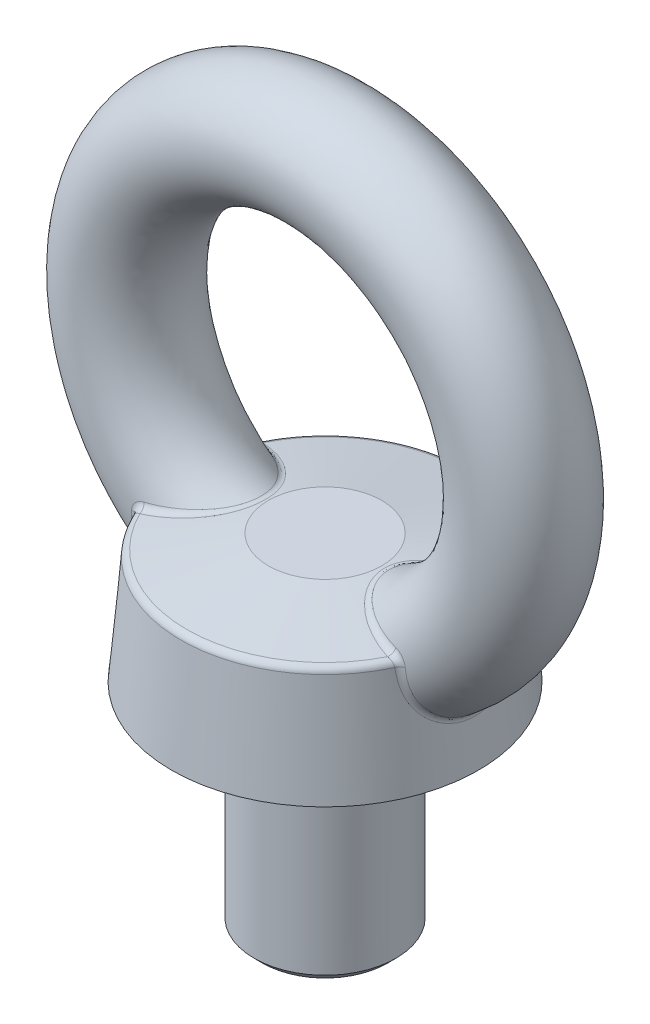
SolidWorks part; units mm, degrees
ref_plane "Front Plane" through (0, 0, 0) normal (0, 0, 1) x (1, 0, 0)
ref_plane "Top Plane" through (0, 0, 0) normal (0, 1, 0) x (1, 0, 0)
ref_plane "Right Plane" through (0, 0, 0) normal (1, 0, 0) x (0, 0, -1)
sketch "Sketch1" plane through (0, 0, 0) normal (0, 0, 1) x (1, 0, 0)
  ellipse E0 centre (0, 54.5) end of major axis (0, 0) minor radius 54
  dimension "D1" = 108
  dimension "D2" = 109
sketch "Sketch2" plane through (0, 0, 0) normal (1, 0, 0) x (0, 0, -1)
  line L3 (0, 109) -> (0, 0) construction
  circle A0 centre (0, 12) radius 12
  point P5 (0, 0)
sweep "Sweep1" add profiles "Sketch2" path "Sketch1"
sketch "Sketch3" plane through (0, 0, 0) normal (1, 0, 0) x (0, 0, -1)
  line L0 (0, 0) -> (-32.5, 0)
  line L1 (-32.5, 0) -> (-30.4003, 24)
  line L2 (-30.4003, 24) -> (-12, 27.2445)
  line L3 (-12, 27.2445) -> (0, 27.2445)
  line L4 (0, 27.2445) -> (0, 0)
revolve "Revolve1" add sketch "Sketch3" angle 360 about L4
fillet "Fillet1" radius 1.5 6 edges at (13.2045, 27.0185, -1.426) (31.5984, 10.3045, 0.0443) (-13.2045, 27.0185, 1.426) (-31.5984, 10.3045, -0.0443) (0, 24, -30.4003) (0, 24, 30.4003)
sketch "Sketch4" plane through (0, 0, 0) normal (0, -1, 0) x (1, 0, 0)
  circle A0 centre (0, 0) radius 15
  dimension "D1" = 30
extrude "Extrude1" add sketch "Sketch4" along normal blind 45
chamfer "Chamfer1" distance 1.75 angle 45 1 edges at (0, -45, -15)
sketch "Sketch5" plane through (0, 0, 0) normal (1, 0, 0) x (0, 0, -1)
  line L0 (-15, 0) -> (-15, -4.7811)
  line L1 (-15, 0) -> (-15, -43.25) construction
  line L2 (-13.25, -1.75) -> (-15, -4.7811)
  line L3 (-13.25, -1.75) -> (-13.25, -0.875)
  line L4 (-14.125, 0) -> (-15, 0)
  line L5 (-14.125, -0.875) -> (-13.25, -0.875) construction
  arc A1 (-13.25, -0.875) -> (-14.125, 0) centre (-14.125, -0.875) ccw
  point P0 (-13.25, -45)
  dimension "D1" = 30
revolve "Cut-Revolve1" cut sketch "Sketch5" angle 360 about axis through (0, -45, 0) along (0, 1, 0)
equation "\"D4@Sketch3\" = \"D1@Sketch2\""
equation "\"D5@Sketch3\" = \"D1@Sketch2\"/2"
